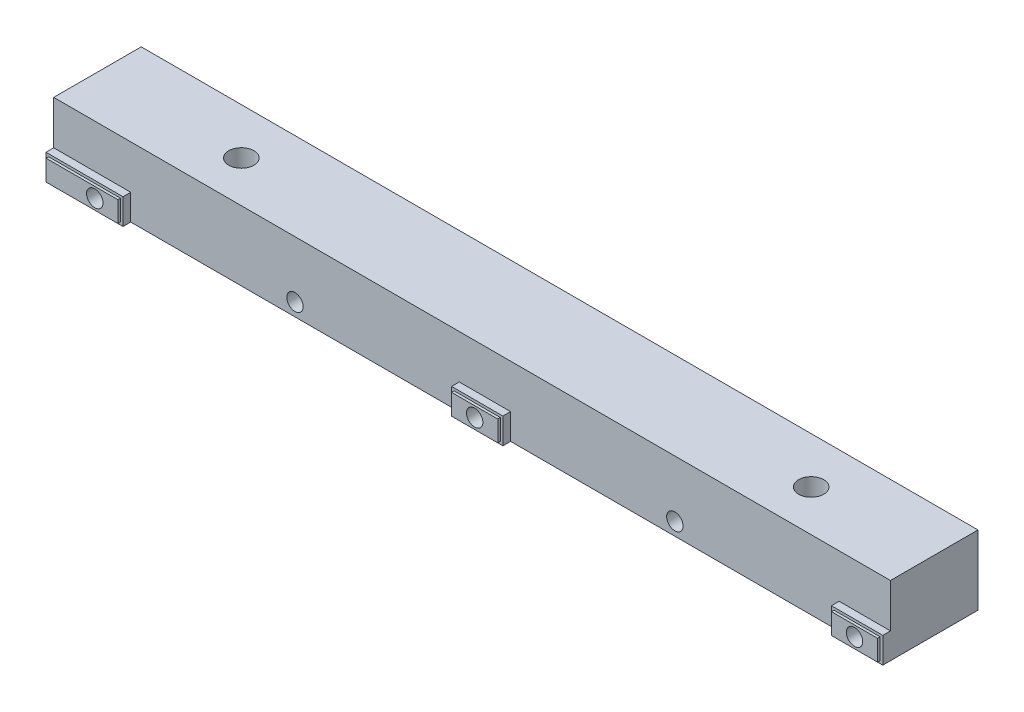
SolidWorks part; units mm, degrees
ref_plane "Front" through (0, 0, 0) normal (0, 0, 1) x (1, 0, 0)
ref_plane "Top" through (0, 0, 0) normal (0, 1, 0) x (1, 0, 0)
ref_plane "Right" through (0, 0, 0) normal (1, 0, 0) x (0, 0, -1)
sketch "Sketch1" plane through (0, 0, 0) normal (0, 1, 0) x (1, 0, 0)
  line L0 (0, 0) -> (0, 8.525) construction
  line L1 (-208, 8.525) -> (208, 8.525)
  line L2 (-208, 8.525) -> (-208, -8.525)
  line L3 (-208, -8.525) -> (208, -8.525)
  line L4 (208, 8.525) -> (208, -8.525)
  line L5 (0, 0) -> (208, 0) construction
  dimension "D1" = 416
  dimension "D2" = 17.05
extrude "Extrude1" add sketch "Sketch1" along normal blind 13.54
sketch "Sketch2" plane through (0, 13.54, 0) normal (0, 1, 0) x (1, 0, 0)
  circle A0 centre (0, -6.025) radius 2.413
  dimension "D1" = 4.826
  dimension "D2" = 6.025
extrude "Extrude2" cut sketch "Sketch2" against normal up to next
sketch "Sketch3" plane through (0, 0, 8.525) normal (0, 0, 1) x (1, 0, 0)
  line L1 (-166, 5.03) -> (-156, 5.03)
  line L2 (-166, 5.03) -> (-166, 0)
  line L3 (-166, 0) -> (-156, 0)
  line L4 (-156, 5.03) -> (-156, 0)
  line L6 (-208, 13.54) -> (-208, 0) construction
  line L7 (-208, 0) -> (208, 0) construction
  dimension "D1" = 42
  dimension "D2" = 10
  dimension "D3" = 5.03
extrude "Extrude3" add sketch "Sketch3" along normal blind 2
pattern_linear "LPattern1" count 4 spacing 37 along (1, 0, 0) of "Extrude3"
sketch "Sketch4" plane through (0, 0, 8.525) normal (0, 0, 1) x (1, 0, 0)
  line L1 (-208, 5.03) -> (-193, 5.03)
  line L2 (-208, 5.03) -> (-208, 0)
  line L3 (-208, 0) -> (-193, 0)
  line L4 (-193, 5.03) -> (-193, 0)
  line L5 (-208, 0) -> (-166, 0) construction
  line L6 (-156, 5.03) -> (-166, 5.03) construction
  line L7 (-208, 13.54) -> (-208, 0) construction
  dimension "D1" = 15
extrude "Extrude4" add sketch "Sketch4" along normal blind 2
sketch "Sketch8" plane through (0, 0, 0) normal (0, -1, 0) x (1, 0, 0)
  line L0 (208, 8.525) -> (208, -8.525) construction
  line L1 (-208, -8.525) -> (208, -8.525)
  line L2 (-208, -8.525) -> (-208, -2.525)
  line L3 (-208, -2.525) -> (208, -2.525)
  line L4 (208, -8.525) -> (208, -2.525)
  dimension "D1" = 6
extrude "Extrude8" [suppressed] add sketch "Sketch8" along normal blind 1
mirror "Mirror1" about plane through (0, 0, 0) normal (1, 0, 0) of "Extrude3", "LPattern1", "Extrude4"
hole_wizard "Ø3.2 (3.2) Diameter Hole1" positions "3DSketch1" profile "Sketch7" hole size "Ø3.2" standard "Ansi Metric"
sketch3d "3DSketch1"
  line L0 (208, 13.54, -8.525) -> (208, 0, -8.525) construction
  line L1 (208, 0, -8.525) -> (-208, 0, -8.525) construction
  point P0 (198, 2.515, -8.525)
  dimension "D1" = 10
  dimension "D2" = 2.515
sketch "Sketch7" plane through (198, 2.515, -8.525) normal (1, 0, 0) x (0, 1, 0)
  line L0 (0, 0) -> (0, 19.05)
  line L1 (0, 19.05) -> (1.6, 19.05)
  line L2 (1.6, 19.05) -> (1.6, 0.1)
  line L3 (1.6, 0.1) -> (1.7, 0)
  line L5 (1.7, 0) -> (0, 0)
  line L6 (-1.6, 0.1) -> (-1.7, 0) construction
  line L11 (0, -6.35) -> (0, 107.95) construction
  dimension "Thru Hole Dia." = 3.2
  dimension "Thru Hole Depth" = 19.05
  dimension "Near C'Sink Dia." = 3.4
  dimension "Near C'Sink Angle" = 90
pattern_linear "LPattern2" count 5 spacing 37 along (-1, 0, 0) of "Ø3.2 (3.2) Diameter Hole1"
mirror "Mirror2" about plane through (0, 0, 0) normal (1, 0, 0) of "Ø3.2 (3.2) Diameter Hole1", "LPattern2"
sketch "Sketch5" plane through (0, 0, 10.525) normal (0, 0, 1) x (1, 0, 0)
  line L8 (-207.5, 4.53) -> (-207.5, 0.5)
  line L9 (-207.5, 0.5) -> (-193.5, 0.5)
  line L10 (-193.5, 0.5) -> (-193.5, 4.53)
  line L11 (-193.5, 4.53) -> (-207.5, 4.53)
  line L12 (-207.5, 4.53) -> (-207.5, 0.5)
  line L13 (-207.5, 0.5) -> (-193.5, 0.5)
  line L14 (-193.5, 0.5) -> (-193.5, 4.53)
  line L15 (-193.5, 4.53) -> (-207.5, 4.53)
  line L20 (-165.5, 4.53) -> (-165.5, 0.5)
  line L21 (-165.5, 0.5) -> (-156.5, 0.5)
  line L22 (-156.5, 0.5) -> (-156.5, 4.53)
  line L23 (-156.5, 4.53) -> (-165.5, 4.53)
  line L24 (-165.5, 4.53) -> (-165.5, 0.5)
  line L25 (-165.5, 0.5) -> (-156.5, 0.5)
  line L26 (-156.5, 0.5) -> (-156.5, 4.53)
  line L27 (-156.5, 4.53) -> (-165.5, 4.53)
  line L32 (-128.5, 4.53) -> (-128.5, 0.5)
  line L33 (-128.5, 0.5) -> (-119.5, 0.5)
  line L34 (-119.5, 0.5) -> (-119.5, 4.53)
  line L35 (-119.5, 4.53) -> (-128.5, 4.53)
  line L36 (-128.5, 4.53) -> (-128.5, 0.5)
  line L37 (-128.5, 0.5) -> (-119.5, 0.5)
  line L38 (-119.5, 0.5) -> (-119.5, 4.53)
  line L39 (-119.5, 4.53) -> (-128.5, 4.53)
  line L44 (-91.5, 4.53) -> (-91.5, 0.5)
  line L45 (-91.5, 0.5) -> (-82.5, 0.5)
  line L46 (-82.5, 0.5) -> (-82.5, 4.53)
  line L47 (-82.5, 4.53) -> (-91.5, 4.53)
  line L48 (-91.5, 4.53) -> (-91.5, 0.5)
  line L49 (-91.5, 0.5) -> (-82.5, 0.5)
  line L50 (-82.5, 0.5) -> (-82.5, 4.53)
  line L51 (-82.5, 4.53) -> (-91.5, 4.53)
  line L56 (-54.5, 4.53) -> (-54.5, 0.5)
  line L57 (-54.5, 0.5) -> (-45.5, 0.5)
  line L58 (-45.5, 0.5) -> (-45.5, 4.53)
  line L59 (-45.5, 4.53) -> (-54.5, 4.53)
  line L60 (-54.5, 4.53) -> (-54.5, 0.5)
  line L61 (-54.5, 0.5) -> (-45.5, 0.5)
  line L62 (-45.5, 0.5) -> (-45.5, 4.53)
  line L63 (-45.5, 4.53) -> (-54.5, 4.53)
  line L68 (54.5, 0.5) -> (54.5, 4.53)
  line L69 (54.5, 4.53) -> (45.5, 4.53)
  line L70 (45.5, 4.53) -> (45.5, 0.5)
  line L71 (45.5, 0.5) -> (54.5, 0.5)
  line L72 (54.5, 0.5) -> (54.5, 4.53)
  line L73 (54.5, 4.53) -> (45.5, 4.53)
  line L74 (45.5, 4.53) -> (45.5, 0.5)
  line L75 (45.5, 0.5) -> (54.5, 0.5)
  line L80 (91.5, 0.5) -> (91.5, 4.53)
  line L81 (91.5, 4.53) -> (82.5, 4.53)
  line L82 (82.5, 4.53) -> (82.5, 0.5)
  line L83 (82.5, 0.5) -> (91.5, 0.5)
  line L84 (91.5, 0.5) -> (91.5, 4.53)
  line L85 (91.5, 4.53) -> (82.5, 4.53)
  line L86 (82.5, 4.53) -> (82.5, 0.5)
  line L87 (82.5, 0.5) -> (91.5, 0.5)
  line L92 (128.5, 0.5) -> (128.5, 4.53)
  line L93 (128.5, 4.53) -> (119.5, 4.53)
  line L94 (119.5, 4.53) -> (119.5, 0.5)
  line L95 (119.5, 0.5) -> (128.5, 0.5)
  line L96 (128.5, 0.5) -> (128.5, 4.53)
  line L97 (128.5, 4.53) -> (119.5, 4.53)
  line L98 (119.5, 4.53) -> (119.5, 0.5)
  line L99 (119.5, 0.5) -> (128.5, 0.5)
  line L104 (165.5, 0.5) -> (165.5, 4.53)
  line L105 (165.5, 4.53) -> (156.5, 4.53)
  line L106 (156.5, 4.53) -> (156.5, 0.5)
  line L107 (156.5, 0.5) -> (165.5, 0.5)
  line L108 (165.5, 0.5) -> (165.5, 4.53)
  line L109 (165.5, 4.53) -> (156.5, 4.53)
  line L110 (156.5, 4.53) -> (156.5, 0.5)
  line L111 (156.5, 0.5) -> (165.5, 0.5)
  line L116 (207.5, 0.5) -> (207.5, 4.53)
  line L117 (207.5, 4.53) -> (193.5, 4.53)
  line L118 (193.5, 4.53) -> (193.5, 0.5)
  line L119 (193.5, 0.5) -> (207.5, 0.5)
  line L120 (207.5, 0.5) -> (207.5, 4.53)
  line L121 (207.5, 4.53) -> (193.5, 4.53)
  line L122 (193.5, 4.53) -> (193.5, 0.5)
  line L123 (193.5, 0.5) -> (207.5, 0.5)
  line L124 (55, 0) -> (55, 5.03)
  line L125 (55, 5.03) -> (45, 5.03)
  line L126 (45, 5.03) -> (45, 0)
  line L127 (45, 0) -> (55, 0)
  line L128 (55, 0) -> (55, 5.03)
  line L129 (55, 5.03) -> (45, 5.03)
  line L130 (45, 5.03) -> (45, 0)
  line L131 (45, 0) -> (55, 0)
  line L132 (-55, 5.03) -> (-55, 0)
  line L133 (-55, 0) -> (-45, 0)
  line L134 (-45, 0) -> (-45, 5.03)
  line L135 (-45, 5.03) -> (-55, 5.03)
  line L136 (-55, 5.03) -> (-55, 0)
  line L137 (-55, 0) -> (-45, 0)
  line L138 (-45, 0) -> (-45, 5.03)
  line L139 (-45, 5.03) -> (-55, 5.03)
  line L140 (-92, 5.03) -> (-92, 0)
  line L141 (-92, 0) -> (-82, 0)
  line L142 (-82, 0) -> (-82, 5.03)
  line L143 (-82, 5.03) -> (-92, 5.03)
  line L144 (-92, 5.03) -> (-92, 0)
  line L145 (-92, 0) -> (-82, 0)
  line L146 (-82, 0) -> (-82, 5.03)
  line L147 (-82, 5.03) -> (-92, 5.03)
  line L148 (-129, 5.03) -> (-129, 0)
  line L149 (-129, 0) -> (-119, 0)
  line L150 (-119, 0) -> (-119, 5.03)
  line L151 (-119, 5.03) -> (-129, 5.03)
  line L152 (-129, 5.03) -> (-129, 0)
  line L153 (-129, 0) -> (-119, 0)
  line L154 (-119, 0) -> (-119, 5.03)
  line L155 (-119, 5.03) -> (-129, 5.03)
  line L156 (-166, 5.03) -> (-166, 0)
  line L157 (-166, 0) -> (-156, 0)
  line L158 (-156, 0) -> (-156, 5.03)
  line L159 (-156, 5.03) -> (-166, 5.03)
  line L160 (-166, 5.03) -> (-166, 0)
  line L161 (-166, 0) -> (-156, 0)
  line L162 (-156, 0) -> (-156, 5.03)
  line L163 (-156, 5.03) -> (-166, 5.03)
  line L164 (-208, 5.03) -> (-208, 0)
  line L165 (-208, 0) -> (-193, 0)
  line L166 (-193, 0) -> (-193, 5.03)
  line L167 (-193, 5.03) -> (-208, 5.03)
  line L168 (-208, 5.03) -> (-208, 0)
  line L169 (-208, 0) -> (-193, 0)
  line L170 (-193, 0) -> (-193, 5.03)
  line L171 (-193, 5.03) -> (-208, 5.03)
  line L172 (92, 0) -> (92, 5.03)
  line L173 (92, 5.03) -> (82, 5.03)
  line L174 (82, 5.03) -> (82, 0)
  line L175 (82, 0) -> (92, 0)
  line L176 (92, 0) -> (92, 5.03)
  line L177 (92, 5.03) -> (82, 5.03)
  line L178 (82, 5.03) -> (82, 0)
  line L179 (82, 0) -> (92, 0)
  line L180 (129, 0) -> (129, 5.03)
  line L181 (129, 5.03) -> (119, 5.03)
  line L182 (119, 5.03) -> (119, 0)
  line L183 (119, 0) -> (129, 0)
  line L184 (129, 0) -> (129, 5.03)
  line L185 (129, 5.03) -> (119, 5.03)
  line L186 (119, 5.03) -> (119, 0)
  line L187 (119, 0) -> (129, 0)
  line L188 (166, 0) -> (166, 5.03)
  line L189 (166, 5.03) -> (156, 5.03)
  line L190 (156, 5.03) -> (156, 0)
  line L191 (156, 0) -> (166, 0)
  line L192 (166, 0) -> (166, 5.03)
  line L193 (166, 5.03) -> (156, 5.03)
  line L194 (156, 5.03) -> (156, 0)
  line L195 (156, 0) -> (166, 0)
  line L196 (208, 0) -> (208, 5.03)
  line L197 (208, 5.03) -> (193, 5.03)
  line L198 (193, 5.03) -> (193, 0)
  line L199 (193, 0) -> (208, 0)
  line L200 (208, 0) -> (208, 5.03)
  line L201 (208, 5.03) -> (193, 5.03)
  line L202 (193, 5.03) -> (193, 0)
  line L203 (193, 0) -> (208, 0)
  dimension "D1" = 0.5
  dimension "D2" = 0.5
  dimension "D3" = 0.5
  dimension "D4" = 0.5
  dimension "D5" = 0.5
  dimension "D6" = 0.5
  dimension "D7" = 0.5
  dimension "D8" = 0.5
  dimension "D9" = 0.5
  dimension "D10" = 0.5
  dimension "D11" = 0
  dimension "D12" = 0
  dimension "D13" = 0
  dimension "D14" = 0
  dimension "D15" = 0
  dimension "D16" = 0
  dimension "D17" = 0
  dimension "D18" = 0
  dimension "D19" = 0
  dimension "D20" = 0
extrude "Extrude6" cut sketch "Sketch5" against normal blind 0.5
hole_wizard "CBORE for #10 Socket Head Cap Screw1" positions "3DSketch2" profile "Sketch12" counterbore size "#10" standard "Ansi Inch"
sketch3d "3DSketch2"
  circle A0 centre (0, 0, 6.025) radius 2.413 construction
  point P0 (0, 0, 6.025)
  point P5 (0, -2.413, 6.025)
sketch "Sketch12" plane through (0, 0, 6.025) normal (1, 0, 0) x (0, 0, -1)
  line L0 (0, 0) -> (0, 13.54)
  line L1 (0, 13.54) -> (2.4892, 13.54)
  line L3 (2.4892, 13.54) -> (2.4892, 4.826)
  line L4 (2.4892, 4.826) -> (4.7625, 4.826)
  line L5 (4.7625, 4.826) -> (4.7625, 0)
  line L7 (4.7625, 0) -> (0, 0)
  line L11 (0, -6.35) -> (0, 107.95) construction
  dimension "Thru Hole Dia." = 4.9784
  dimension "Thru Hole Depth" = 13.54
  dimension "C'Bore Dia." = 9.525
  dimension "C'Bore Depth" = 4.826
sketch "Sketch15" plane through (0, 0, 0) normal (0, -1, 0) x (1, 0, 0)
  line L41 (-208, -8.525) -> (208, -8.525)
  line L42 (-208, -8.525) -> (208, -8.525)
  line L59 (-4.0536, 8.525) -> (-45, 8.525)
  line L60 (-4.0536, 8.525) -> (-45, 8.525)
  line L75 (-45, 8.525) -> (-45, 10.025)
  line L76 (-45, 10.025) -> (-55, 10.025)
  line L77 (-55, 10.025) -> (-55, 8.525)
  line L78 (-55, 8.525) -> (-82, 8.525)
  line L81 (-82, 8.525) -> (-82, 10.025)
  line L82 (-82, 10.025) -> (-92, 10.025)
  line L83 (-92, 10.025) -> (-92, 8.525)
  line L84 (-92, 8.525) -> (-119, 8.525)
  line L87 (-119, 8.525) -> (-119, 10.025)
  line L88 (-119, 10.025) -> (-129, 10.025)
  line L89 (-129, 10.025) -> (-129, 8.525)
  line L90 (-129, 8.525) -> (-156, 8.525)
  line L93 (-156, 8.525) -> (-156, 10.025)
  line L94 (-156, 10.025) -> (-166, 10.025)
  line L95 (-166, 10.025) -> (-166, 8.525)
  line L96 (-166, 8.525) -> (-193, 8.525)
  line L99 (-193, 8.525) -> (-193, 10.025)
  line L100 (-193, 10.025) -> (-208, 10.025)
  line L101 (-208, 10.025) -> (-208, -8.525)
  line L103 (208, -8.525) -> (208, 10.025)
  line L104 (208, 10.025) -> (193, 10.025)
  line L105 (193, 10.025) -> (193, 8.525)
  line L106 (193, 8.525) -> (166, 8.525)
  line L109 (166, 8.525) -> (166, 10.025)
  line L110 (166, 10.025) -> (156, 10.025)
  line L111 (156, 10.025) -> (156, 8.525)
  line L112 (156, 8.525) -> (129, 8.525)
  line L115 (129, 8.525) -> (129, 10.025)
  line L116 (129, 10.025) -> (119, 10.025)
  line L117 (119, 10.025) -> (119, 8.525)
  line L118 (119, 8.525) -> (92, 8.525)
  line L121 (92, 8.525) -> (92, 10.025)
  line L122 (92, 10.025) -> (82, 10.025)
  line L123 (82, 10.025) -> (82, 8.525)
  line L124 (82, 8.525) -> (55, 8.525)
  line L127 (55, 8.525) -> (55, 10.025)
  line L128 (55, 10.025) -> (45, 10.025)
  line L129 (45, 10.025) -> (45, 8.525)
  line L130 (45, 8.525) -> (4.0536, 8.525)
  line L142 (-45, 8.525) -> (-45, 10.025)
  line L143 (-45, 10.025) -> (-55, 10.025)
  line L144 (-55, 10.025) -> (-55, 8.525)
  line L145 (-55, 8.525) -> (-82, 8.525)
  line L148 (-82, 8.525) -> (-82, 10.025)
  line L149 (-82, 10.025) -> (-92, 10.025)
  line L150 (-92, 10.025) -> (-92, 8.525)
  line L151 (-92, 8.525) -> (-119, 8.525)
  line L154 (-119, 8.525) -> (-119, 10.025)
  line L155 (-119, 10.025) -> (-129, 10.025)
  line L156 (-129, 10.025) -> (-129, 8.525)
  line L157 (-129, 8.525) -> (-156, 8.525)
  line L160 (-156, 8.525) -> (-156, 10.025)
  line L161 (-156, 10.025) -> (-166, 10.025)
  line L162 (-166, 10.025) -> (-166, 8.525)
  line L163 (-166, 8.525) -> (-193, 8.525)
  line L166 (-193, 8.525) -> (-193, 10.025)
  line L167 (-193, 10.025) -> (-208, 10.025)
  line L168 (-208, 10.025) -> (-208, -8.525)
  line L170 (208, -8.525) -> (208, 10.025)
  line L171 (208, 10.025) -> (193, 10.025)
  line L172 (193, 10.025) -> (193, 8.525)
  line L173 (193, 8.525) -> (166, 8.525)
  line L176 (166, 8.525) -> (166, 10.025)
  line L177 (166, 10.025) -> (156, 10.025)
  line L178 (156, 10.025) -> (156, 8.525)
  line L179 (156, 8.525) -> (129, 8.525)
  line L182 (129, 8.525) -> (129, 10.025)
  line L183 (129, 10.025) -> (119, 10.025)
  line L184 (119, 10.025) -> (119, 8.525)
  line L185 (119, 8.525) -> (92, 8.525)
  line L188 (92, 8.525) -> (92, 10.025)
  line L189 (92, 10.025) -> (82, 10.025)
  line L190 (82, 10.025) -> (82, 8.525)
  line L191 (82, 8.525) -> (55, 8.525)
  line L194 (55, 8.525) -> (55, 10.025)
  line L195 (55, 10.025) -> (45, 10.025)
  line L196 (45, 10.025) -> (45, 8.525)
  line L197 (45, 8.525) -> (4.0536, 8.525)
  arc A1 (-4.0536, 8.525) -> (4.0536, 8.525) centre (0, 6.025) ccw
  arc A2 (-4.0536, 8.525) -> (4.0536, 8.525) centre (0, 6.025) ccw
  dimension "D1" = 0
extrude "Extrude14" [suppressed] add sketch "Sketch15" along normal up to surface (1 mm away)
ref_plane "Plane1" through (-193.5, 4.53, 10.525) normal (0, 1, 0) x (-1, 0, 0)
sketch "Sketch19" plane through (0, 0, 0) normal (0, -1, 0) x (1, 0, 0)
  line L0 (-45, 8.525) -> (-45, -8.525)
  line L2 (208, -8.525) -> (-208, -8.525) construction
extrude "Extrude17" cut sketch "Sketch19" against normal through all and the other way through all
hole_wizard "#10 (0.1935) Diameter Hole1" positions "3DSketch3" profile "Sketch20" hole size "#10" standard "Ansi Inch"
sketch3d "3DSketch3"
  line L0 (-179.5, 0, 8.525) -> (-179.5, 0, 0.475) construction
  line L1 (-193, 0, 8.525) -> (-166, 0, 8.525) construction
  line L2 (-68.5, 0, 8.525) -> (-68.5, 0, 0.475) construction
  line L3 (-82, 0, 8.525) -> (-55, 0, 8.525) construction
  line L4 (-179.5, 0, 0.475) -> (-68.5, 0, 0.475) construction
  line L5 (-45, 0, -8.525) -> (-208, 0, -8.525) construction
  point P0 (-179.5, 0, 0.475)
  point P2 (-68.5, 0, 0.475)
  dimension "D1" = 9
sketch "Sketch20" plane through (-179.5, 0, 0.475) normal (1, 0, 0) x (0, 0, -1)
  line L0 (0, 0) -> (0, 13.54)
  line L1 (0, 13.54) -> (2.4574, 13.54)
  line L2 (2.4574, 13.54) -> (2.4574, 0.3366)
  line L3 (2.4574, 0.3366) -> (2.794, 0)
  line L5 (2.794, 0) -> (0, 0)
  line L6 (-2.4574, 0.3366) -> (-2.794, 0) construction
  line L11 (0, -6.35) -> (0, 107.95) construction
  dimension "Thru Hole Dia." = 4.9149
  dimension "Thru Hole Depth" = 13.54
  dimension "Near C'Sink Dia." = 5.588
  dimension "Near C'Sink Angle" = 90
sketch "Sketch21" plane through (0, 0, 8.525) normal (0, 0, 1) x (1, 0, 0)
  line L1 (-92, 0) -> (-82, 0)
  line L2 (-92, 0) -> (-92, 5.03)
  line L3 (-92, 5.03) -> (-82, 5.03)
  line L4 (-82, 0) -> (-82, 5.03)
  line L5 (-166, 0) -> (-156, 0)
  line L6 (-166, 0) -> (-166, 5.03)
  line L7 (-166, 5.03) -> (-156, 5.03)
  line L8 (-156, 0) -> (-156, 5.03)
extrude "Extrude18" cut sketch "Sketch21" along normal through all
